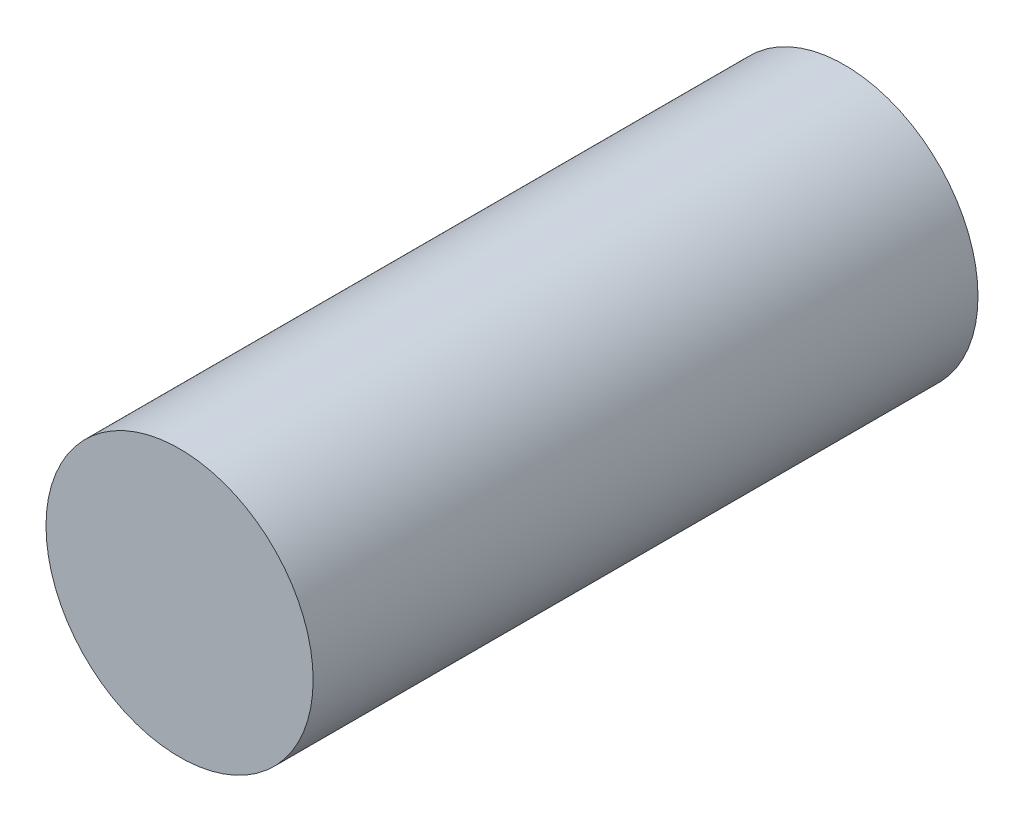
SolidWorks part; units mm, degrees
ref_plane "Front Plane" through (0, 0, 0) normal (0, 0, 1) x (1, 0, 0)
ref_plane "Top Plane" through (0, 0, 0) normal (0, 1, 0) x (1, 0, 0)
ref_plane "Right Plane" through (0, 0, 0) normal (1, 0, 0) x (0, 0, -1)
sketch "Sketch1" plane through (0, 0, 0) normal (0, 0, 1) x (1, 0, 0)
  circle A0 centre (0, 0) radius 112.5
  dimension "D1" = 225
extrude "Boss-Extrude1" add sketch "Sketch1" along normal mid plane 560
